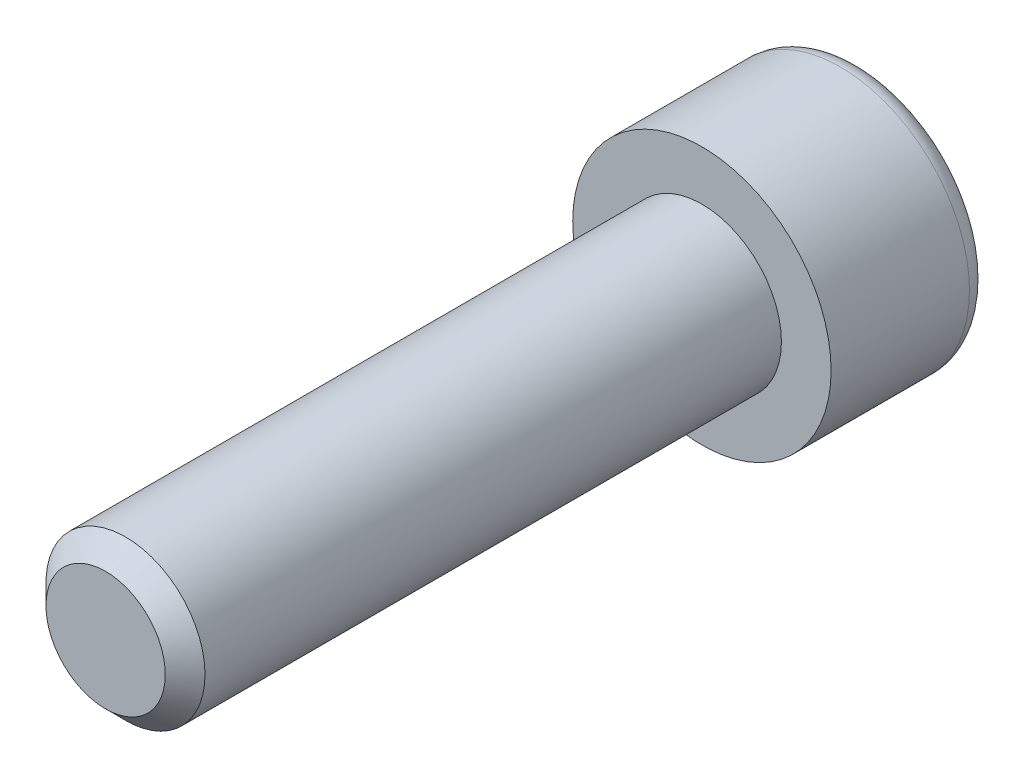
SolidWorks part; units mm, degrees
ref_plane "Plan1" through (0, 0, 0) normal (0, 0, 1) x (1, 0, 0)
ref_plane "Plan2" through (0, 0, 0) normal (0, 1, 0) x (1, 0, 0)
ref_plane "Plan3" through (0, 0, 0) normal (1, 0, 0) x (0, 0, -1)
sketch "Esquisse1" plane through (0, 0, 0) normal (0, 0, 1) x (1, 0, 0)
  circle A0 centre (0, 0) radius 4
extrude "Corps" add sketch "Esquisse1" along normal blind 30
sketch "Esquisse2" plane through (0, 0, 0) normal (0, 0, 1) x (1, 0, 0)
  circle A0 centre (0, 0) radius 6.5
extrude "Tete" add sketch "Esquisse2" against normal blind 8
ref_plane "Plan4" through (0, 0, -8) normal (0, 0, 1) x (1, 0, 0)
sketch "Esquisse3" plane through (0, 0, -8) normal (0, 0, 1) x (1, 0, 0)
  line L1 (0, -3.4641) -> (3, -1.7321)
  line L2 (3, -1.7321) -> (3, 1.7321)
  line L3 (3, 1.7321) -> (0, 3.4641)
  line L4 (0, 3.4641) -> (-3, 1.7321)
  line L5 (-3, 1.7321) -> (-3, -1.7321)
  line L6 (-3, -1.7321) -> (0, -3.4641)
  circle A0 centre (0, 0) radius 3 construction
  dimension "D1" = 6
extrude "6pans" cut sketch "Esquisse3" along normal blind 5.6
chamfer "Chanfrein2" distance 1 angle 45 1 edges at (4, 0, 30)
fillet "Congé1" radius 1.04 1 edges at (6.5, 0, -8)
equation "\"D1@Congé1\"=\"D1@Esquisse2\"*0.08"
equation "\"D1@Chanfrein2\"=\"D@Esquisse1\"*0.15"
equation "\"HT@6pans\"=\"HT@Tete\"*0.7"
equation "\"D1@Plan4\" = \"HT@Tete\""
